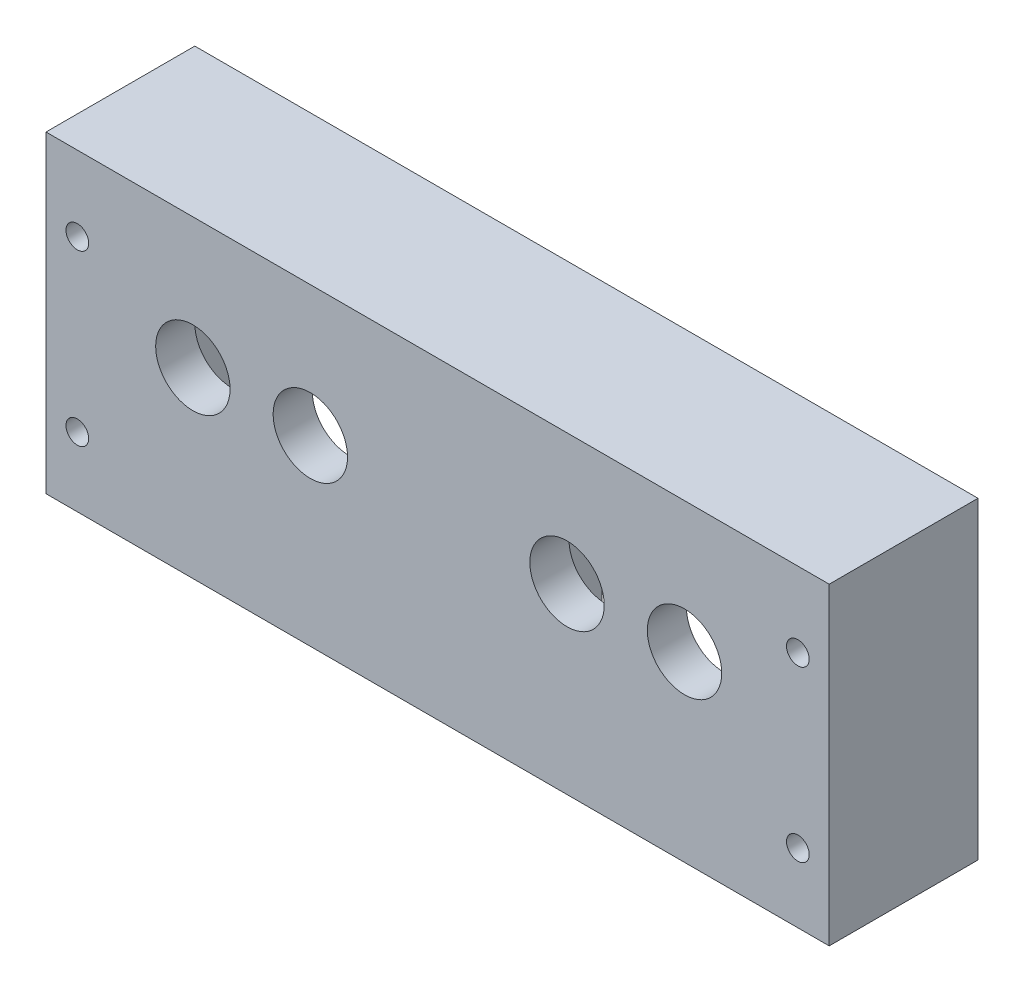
SolidWorks part; units mm, degrees
ref_plane "Front Plane" through (0, 0, 0) normal (0, 0, 1) x (1, 0, 0)
ref_plane "Top Plane" through (0, 0, 0) normal (0, 1, 0) x (1, 0, 0)
ref_plane "Right Plane" through (0, 0, 0) normal (1, 0, 0) x (0, 0, -1)
sketch "Sketch1" plane through (0, 0, 0) normal (0, 0, 1) x (1, 0, 0)
  line L1 (-33.75, 21.5625) -> (66.25, 21.5625)
  line L2 (-33.75, 21.5625) -> (-33.75, -18.4375)
  line L3 (-33.75, -18.4375) -> (66.25, -18.4375)
  line L4 (66.25, 21.5625) -> (66.25, -18.4375)
  dimension "D1" = 100
  dimension "D2" = 40
extrude "Boss-Extrude1" add sketch "Sketch1" along normal blind 38
sketch "Sketch2" plane through (0, 0, 0) normal (0, 0, -1) x (-1, 0, 0)
  line L0 (-66.25, -18.4375) -> (-66.25, 21.5625) construction
  line L1 (-58.25, 18.5625) -> (-18.75, 18.5625)
  line L2 (-58.25, 18.5625) -> (-58.25, -15.4375)
  line L3 (-58.25, -15.4375) -> (-18.75, -15.4375)
  line L4 (-18.75, 18.5625) -> (-18.75, -15.4375)
  line L5 (-13.75, 18.5625) -> (25.75, 18.5625)
  line L6 (-13.75, 18.5625) -> (-13.75, -15.4375)
  line L7 (-13.75, -15.4375) -> (25.75, -15.4375)
  line L8 (25.75, 18.5625) -> (25.75, -15.4375)
  line L9 (33.75, 21.5625) -> (33.75, -18.4375) construction
  line L10 (-66.25, 21.5625) -> (33.75, 21.5625) construction
  line L11 (33.75, -18.4375) -> (-66.25, -18.4375) construction
  dimension "D1" = 8
  dimension "D2" = 8
  dimension "D3" = 5
  dimension "D4" = 3
  dimension "D5" = 3
  dimension "D6" = 3
  dimension "D7" = 3
  dimension "D8" = 39.5
  dimension "D9" = 39.5
extrude "Cut-Extrude2" cut sketch "Sketch2" against normal blind 21 from offset 12
sketch "Sketch3" plane through (-3.3623, 0, 0) normal (0, 0, -1) x (-1, 0, 0)
  arc A0 (-55.6418, 7.0775) -> (16.2528, 4.0018) centre (-18.1567, 41.487) ccw construction
  arc A1 (-61.5934, 1.6143) -> (21.716, -1.9497) centre (-18.1567, 41.487) ccw
  arc A2 (-49.6903, 12.5407) -> (10.7896, 9.9533) centre (-18.1567, 41.487) ccw
  arc A3 (-49.6903, 12.5407) -> (-61.5934, 1.6143) centre (-55.6418, 7.0775) ccw
  arc A4 (21.716, -1.9497) -> (10.7896, 9.9533) centre (16.2528, 4.0018) ccw
  point P3 (-20.3315, -9.3502)
extrude "Cut-Extrude3" cut sketch "Sketch3" against normal blind 9 contours A2 A4 A1 A3
sketch "Sketch4" plane through (0, 0, 0) normal (0, 0, -1) x (-1, 0, 0)
  line L0 (-66.25, -18.4375) -> (-66.25, 21.5625) construction
  line L1 (33.75, 21.5625) -> (33.75, -18.4375) construction
  circle A0 centre (-62.25, 11.9848) radius 1.45
  circle A1 centre (-62.25, -9.6166) radius 1.45
  circle A2 centre (29.75, 11.9848) radius 1.45
  circle A3 centre (29.75, -9.6166) radius 1.45
  dimension "D1" = 4
  dimension "D2" = 4
extrude "Cut-Extrude4" cut sketch "Sketch4" against normal up to next
sketch "Sketch5" plane through (0, 21.5625, 0) normal (0, 1, 0) x (1, 0, 0)
  line L0 (-33.75, -38) -> (-33.75, 0) construction
  line L1 (66.25, 0) -> (-33.75, 0)
  line L2 (66.25, 0) -> (66.25, -19)
  line L3 (66.25, -19) -> (-33.75, -19)
  line L4 (-33.75, 0) -> (-33.75, -19)
extrude "Cut-Extrude5" cut sketch "Sketch5" against normal through all
fillet "Fillet1" radius 0.5 8 edges at (18.75, 18.5625, 26) (58.25, 18.5625, 26) (58.25, -15.4375, 26) (18.75, -15.4375, 26) (13.75, -15.4375, 26) (13.75, 18.5625, 26) (-25.75, 18.5625, 26) (-25.75, -15.4375, 26)
sketch "Sketch8" plane through (0, 0, 33) normal (0, 0, -1) x (-1, 0, 0)
  line L8 (-18.25, -14.9375) -> (-18.25, 18.0625)
  line L9 (-19.25, 19.0625) -> (-57.75, 19.0625)
  line L10 (-58.75, 18.0625) -> (-58.75, -14.9375)
  line L11 (-57.75, -15.9375) -> (-19.25, -15.9375)
  line L12 (-18.25, -14.9375) -> (-18.25, 18.0625)
  line L13 (-19.25, 19.0625) -> (-57.75, 19.0625)
  line L14 (-58.75, 18.0625) -> (-58.75, -14.9375)
  line L15 (-57.75, -15.9375) -> (-19.25, -15.9375)
  arc A8 (-18.25, 18.0625) -> (-19.25, 19.0625) centre (-19.25, 18.0625) ccw
  arc A9 (-57.75, 19.0625) -> (-58.75, 18.0625) centre (-57.75, 18.0625) ccw
  arc A10 (-58.75, -14.9375) -> (-57.75, -15.9375) centre (-57.75, -14.9375) ccw
  arc A11 (-19.25, -15.9375) -> (-18.25, -14.9375) centre (-19.25, -14.9375) ccw
  arc A12 (-18.25, 18.0625) -> (-19.25, 19.0625) centre (-19.25, 18.0625) ccw
  arc A13 (-57.75, 19.0625) -> (-58.75, 18.0625) centre (-57.75, 18.0625) ccw
  arc A14 (-58.75, -14.9375) -> (-57.75, -15.9375) centre (-57.75, -14.9375) ccw
  arc A15 (-19.25, -15.9375) -> (-18.25, -14.9375) centre (-19.25, -14.9375) ccw
  dimension "D1" = 0.5
extrude "Cut-Extrude9" cut sketch "Sketch8" along normal blind 0.5 draft 2 from offset 13.5
sketch "Sketch9" plane through (0, 0, 33) normal (0, 0, -1) x (-1, 0, 0)
  line L8 (-14.25, 18.0625) -> (-14.25, -14.9375)
  line L9 (-13.25, -15.9375) -> (25.25, -15.9375)
  line L10 (26.25, -14.9375) -> (26.25, 18.0625)
  line L11 (25.25, 19.0625) -> (-13.25, 19.0625)
  line L12 (-14.25, 18.0625) -> (-14.25, -14.9375)
  line L13 (-13.25, -15.9375) -> (25.25, -15.9375)
  line L14 (26.25, -14.9375) -> (26.25, 18.0625)
  line L15 (25.25, 19.0625) -> (-13.25, 19.0625)
  arc A8 (-14.25, -14.9375) -> (-13.25, -15.9375) centre (-13.25, -14.9375) ccw
  arc A9 (25.25, -15.9375) -> (26.25, -14.9375) centre (25.25, -14.9375) ccw
  arc A10 (26.25, 18.0625) -> (25.25, 19.0625) centre (25.25, 18.0625) ccw
  arc A11 (-13.25, 19.0625) -> (-14.25, 18.0625) centre (-13.25, 18.0625) ccw
  arc A12 (-14.25, -14.9375) -> (-13.25, -15.9375) centre (-13.25, -14.9375) ccw
  arc A13 (25.25, -15.9375) -> (26.25, -14.9375) centre (25.25, -14.9375) ccw
  arc A14 (26.25, 18.0625) -> (25.25, 19.0625) centre (25.25, 18.0625) ccw
  arc A15 (-13.25, 19.0625) -> (-14.25, 18.0625) centre (-13.25, 18.0625) ccw
  dimension "D1" = 0.5
extrude "Cut-Extrude10" cut sketch "Sketch9" along normal blind 0.5 draft 2 from offset 13.5
sketch "Sketch10" plane through (0, 0, 33) normal (0, 0, -1) x (-1, 0, 0)
  circle A0 centre (-47.7772, 4.8517) radius 4.75
  circle A1 centre (-32.7772, 4.8697) radius 4.75
  circle A2 centre (0, 4.8745) radius 4.75
  circle A3 centre (15, 4.8745) radius 4.75
  point P8 (-47.7772, 4.8697)
  dimension "D1" = 15
  dimension "D2" = 15
extrude "Cut-Extrude11" cut sketch "Sketch10" against normal up to next
